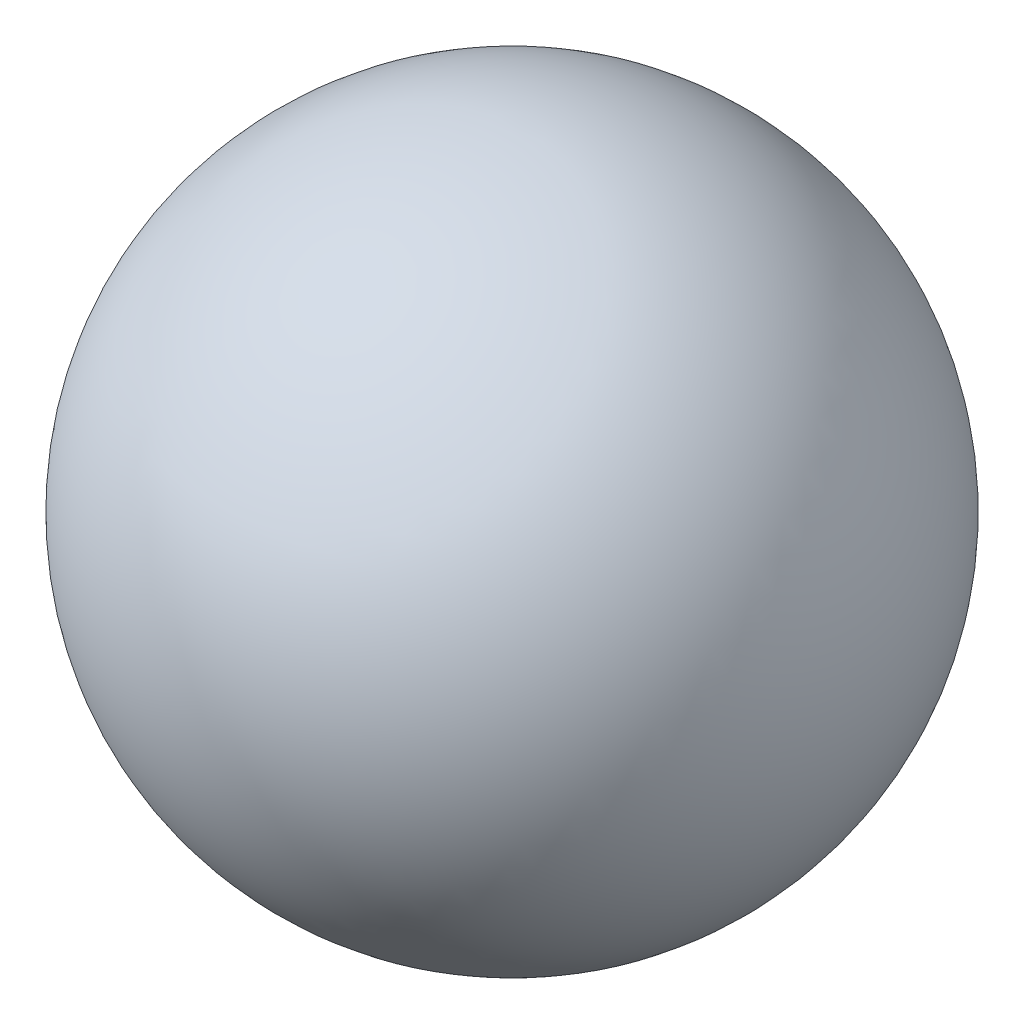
SolidWorks part; units mm, degrees
ref_plane "Front Plane" through (0, 0, 0) normal (0, 0, 1) x (1, 0, 0)
ref_plane "Top Plane" through (0, 0, 0) normal (0, 1, 0) x (1, 0, 0)
ref_plane "Right Plane" through (0, 0, 0) normal (1, 0, 0) x (0, 0, -1)
sketch "Sketch1" plane through (0, 0, 0) normal (0, 0, 1) x (1, 0, 0)
  line L0 (0, 14.4039) -> (0, -19.6594) construction
  line L1 (0, -55) -> (0, 55) construction
  line L2 (0, 1.5875) -> (0, -1.5875)
  line L3 (55, 0) -> (-55, 0) construction
  arc A0 (0, 1.5875) -> (0, -1.5875) centre (0, 0) cw
  dimension "D1" = 3.175
revolve "Revolve1" add sketch "Sketch1" angle 360 about L0
sketch "Sketch2" plane through (0, 0, 0) normal (0, 0, 1) x (1, 0, 0)
  line L0 (1.5123, 0) -> (-1.5123, 0) construction
  line L1 (-1.5875, 1.016) -> (1.5875, 1.016)
  line L2 (-1.5875, 1.016) -> (-1.5875, -1.5875)
  line L3 (-1.5875, -1.5875) -> (1.5875, -1.5875)
  line L4 (1.5875, 1.016) -> (1.5875, -1.5875)
  circle A0 centre (0, 0) radius 1.5875 construction
  dimension "D1" = 1.016
extrude "Cut-Extrude1" [suppressed] cut sketch "Sketch2" against normal through all and the other way through all
sketch "Sketch3" plane through (0, 0, 0) normal (0, 1, 0) x (1, 0, 0)
  circle A0 centre (0, 0) radius 0.7937
  dimension "D1" = 1.5875
extrude "Cut-Extrude2" [suppressed] cut sketch "Sketch3" against normal blind 2.54 and the other way through all flip side to cut
